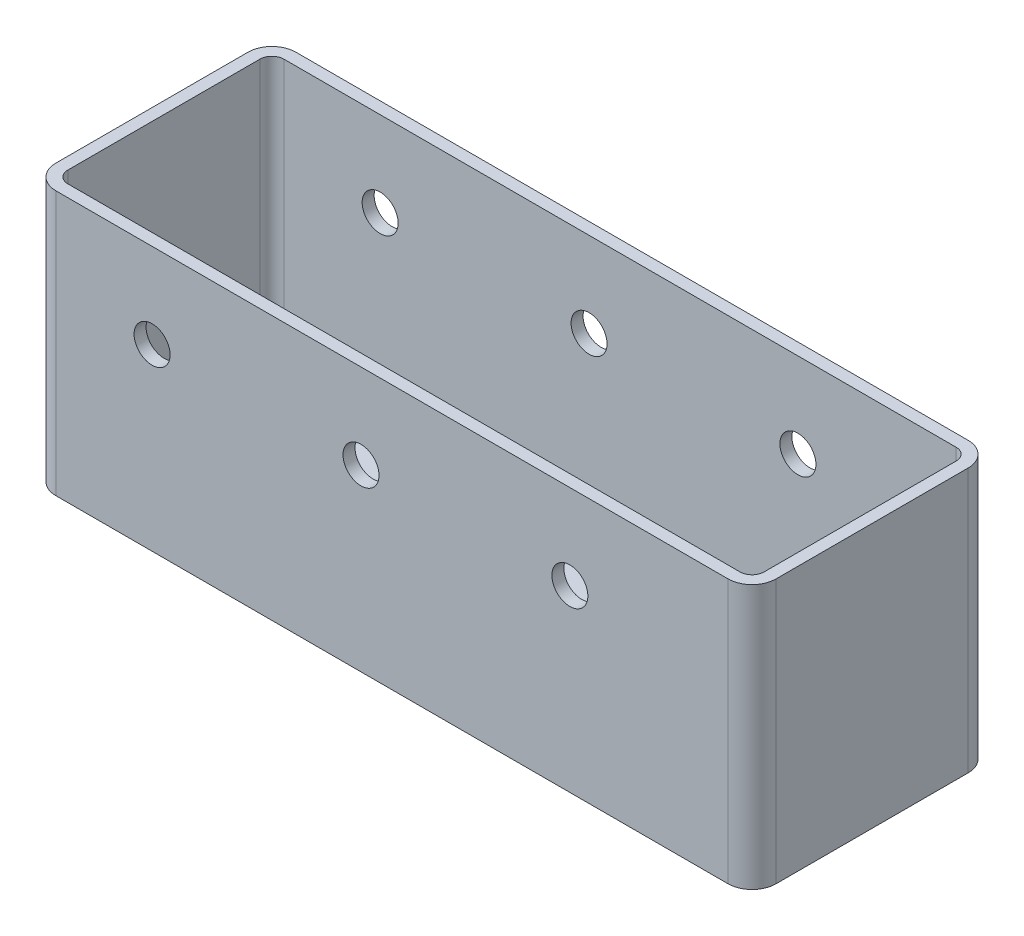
SolidWorks part; units mm, degrees
ref_plane "Front Plane" through (0, 0, 0) normal (0, 0, 1) x (1, 0, 0)
ref_plane "Top Plane" through (0, 0, 0) normal (0, 1, 0) x (1, 0, 0)
ref_plane "Right Plane" through (0, 0, 0) normal (1, 0, 0) x (0, 0, -1)
sketch "Sketch2" plane through (0, 0, 0) normal (0, 1, 0) x (1, 0, 0)
  line L1 (355.6, 127) -> (-355.6, 127)
  line L2 (381, 101.6) -> (381, -101.6)
  line L3 (355.6, -127) -> (-355.6, -127)
  line L4 (-381, 101.6) -> (-381, -101.6)
  line L5 (381, 127) -> (-381, -127) construction
  line L6 (381, -127) -> (-381, 127) construction
  arc A0 (381, -101.6) -> (355.6, -127) centre (355.6, -101.6) cw
  arc A1 (355.6, 127) -> (381, 101.6) centre (355.6, 101.6) cw
  arc A2 (-355.6, 127) -> (-381, 101.6) centre (-355.6, 101.6) ccw
  arc A3 (-355.6, -127) -> (-381, -101.6) centre (-355.6, -101.6) cw
  point P0 (0, 0)
  dimension "D3" = 25.4
  dimension "D1" = 254
  dimension "D2" = 762
extrude "Boss-Extrude1" add sketch "Sketch2" along normal blind 12.7
sketch "Sketch4" plane through (0, 12.7, 0) normal (0, 1, 0) x (1, 0, 0)
  line L0 (-368.3, 101.6) -> (-368.3, -101.6)
  line L1 (-355.6, -114.3) -> (355.6, -114.3)
  line L2 (368.3, -101.6) -> (368.3, 101.6)
  line L3 (355.6, 114.3) -> (-355.6, 114.3)
  line L4 (381, -101.6) -> (381, 101.6)
  line L5 (355.6, 127) -> (-355.6, 127)
  line L6 (-381, 101.6) -> (-381, -101.6)
  line L7 (-355.6, -127) -> (355.6, -127)
  line L8 (381, -101.6) -> (381, 101.6)
  line L9 (355.6, 127) -> (-355.6, 127)
  line L10 (-381, 101.6) -> (-381, -101.6)
  line L11 (-355.6, -127) -> (355.6, -127)
  arc A0 (-368.3, -101.6) -> (-355.6, -114.3) centre (-355.6, -101.6) ccw
  arc A1 (355.6, -114.3) -> (368.3, -101.6) centre (355.6, -101.6) ccw
  arc A2 (368.3, 101.6) -> (355.6, 114.3) centre (355.6, 101.6) ccw
  arc A3 (-355.6, 114.3) -> (-368.3, 101.6) centre (-355.6, 101.6) ccw
  arc A4 (355.6, -127) -> (381, -101.6) centre (355.6, -101.6) ccw
  arc A5 (381, 101.6) -> (355.6, 127) centre (355.6, 101.6) ccw
  arc A6 (-355.6, 127) -> (-381, 101.6) centre (-355.6, 101.6) ccw
  arc A7 (-381, -101.6) -> (-355.6, -127) centre (-355.6, -101.6) ccw
  arc A8 (355.6, -127) -> (381, -101.6) centre (355.6, -101.6) ccw
  arc A9 (381, 101.6) -> (355.6, 127) centre (355.6, 101.6) ccw
  arc A10 (-355.6, 127) -> (-381, 101.6) centre (-355.6, 101.6) ccw
  arc A11 (-381, -101.6) -> (-355.6, -127) centre (-355.6, -101.6) ccw
  dimension "D1" = 0
  dimension "D2" = 12.7
extrude "Boss-Extrude2" add sketch "Sketch4" along normal blind 266.7
sketch "Sketch5" plane through (0, 0, 0) normal (0, 0, 1) x (1, 0, 0)
  line L0 (-355.6, 0) -> (355.6, 0) construction
  line L3 (-381, 279.4) -> (-381, 0) construction
  circle A0 centre (-253.7983, 189.484) radius 19.05
  circle A1 centre (-32.766, 189.484) radius 19.05
  circle A2 centre (188.214, 189.484) radius 19.05
  dimension "D7" = 38.1
  dimension "D1" = 189.484
  dimension "D2" = 189.484
  dimension "D3" = 189.484
  dimension "D4" = 221.0323
  dimension "D5" = 220.98
  dimension "D6" = 127.2017
extrude "Cut-Extrude1" cut sketch "Sketch5" against normal mid plane 381
